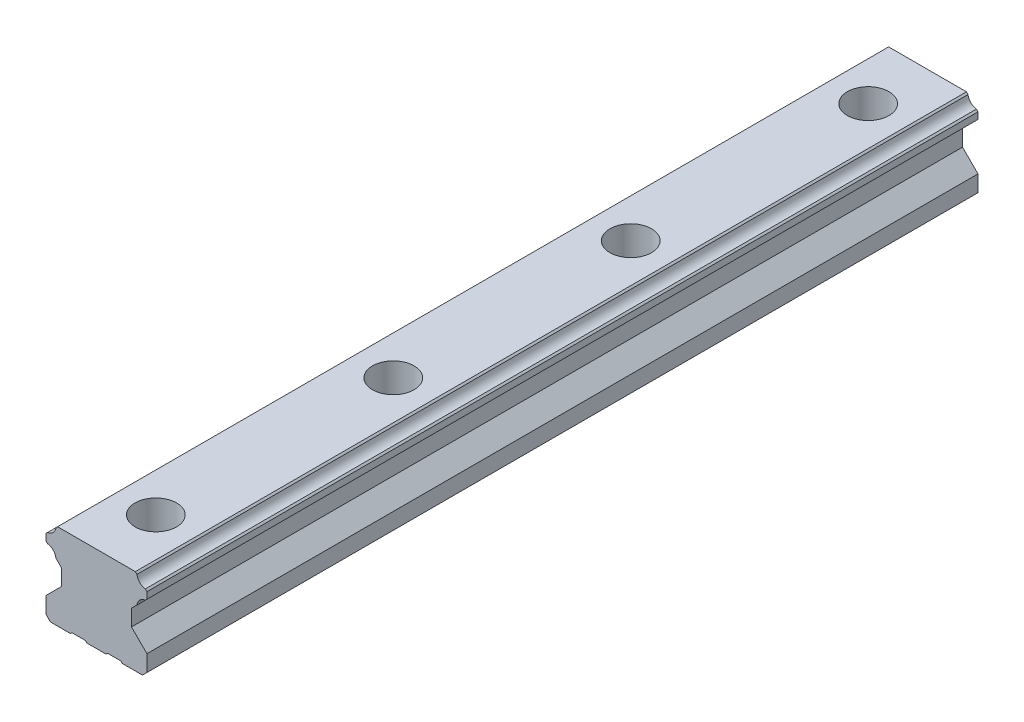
SolidWorks part; units mm, degrees
ref_plane "Front Plane" through (0, 0, 0) normal (0, 0, 1) x (1, 0, 0)
ref_plane "Top Plane" through (0, 0, 0) normal (0, 1, 0) x (1, 0, 0)
ref_plane "Right Plane" through (0, 0, 0) normal (1, 0, 0) x (0, 0, -1)
sketch "Sketch1" plane through (0, 0, 0) normal (0, 0, 1) x (1, 0, 0)
  line L0 (-13.6398, 28.4703) -> (-13.1102, 29)
  line L1 (-17, 25.1102) -> (-16.4686, 25.6415)
  line L2 (-17, 25.1102) -> (-17, 22.8793)
  line L3 (-16.4816, 22.3609) -> (-17, 22.8793)
  line L4 (-13.6381, 19.5174) -> (-11.8003, 17.6796)
  line L5 (-11.8003, 17.6796) -> (-11.8003, 12.1999)
  line L6 (-11.8003, 12.1999) -> (-17, 7.0002)
  line L7 (-17, 7.0002) -> (-17, 1.5)
  line L8 (-17, 1.5) -> (-15.5, 0)
  line L9 (-15.5, 0) -> (-8.745, 0)
  line L10 (-8.245, 0.5) -> (-8.745, 0)
  line L11 (-8.245, 0.5) -> (-3.75, 0.5)
  line L12 (-3.25, 0) -> (-3.75, 0.5)
  line L13 (-3.25, 0) -> (3.25, 0)
  line L14 (3.75, 0.5) -> (3.25, 0)
  line L15 (3.75, 0.5) -> (8.245, 0.5)
  line L16 (8.745, 0) -> (8.245, 0.5)
  line L17 (8.745, 0) -> (15.5, 0)
  line L18 (15.5, 0) -> (17, 1.5)
  line L19 (17, 1.5) -> (17, 7.0002)
  line L20 (17, 7.0002) -> (11.8003, 12.1999)
  line L21 (11.8003, 12.1999) -> (11.8003, 17.6796)
  line L22 (11.8003, 17.6796) -> (13.6381, 19.5174)
  line L23 (17, 22.8793) -> (16.4816, 22.3609)
  line L24 (17, 22.8793) -> (17, 25.1102)
  line L25 (16.4686, 25.6415) -> (17, 25.1102)
  line L26 (13.1102, 29) -> (13.6398, 28.4703)
  line L27 (-13.1102, 29) -> (13.1102, 29)
  arc A0 (-16.4686, 25.6415) -> (-13.6398, 28.4703) centre (-16.9102, 28.9119) ccw
  arc A1 (-13.6381, 19.5174) -> (-16.4816, 22.3609) centre (-16.9102, 19.0889) ccw
  arc A2 (16.4816, 22.3609) -> (13.6381, 19.5174) centre (16.9102, 19.0889) ccw
  arc A3 (13.6398, 28.4703) -> (16.4686, 25.6415) centre (16.9102, 28.9119) ccw
extrude "Boss-Extrude1" add sketch "Sketch1" along normal mid plane 280
hole_wizard "CBORE for M4 Hex Socket Head Cap Screw1" positions "Sketch2" profile "Sketch3" counterbore size "M4" standard "DIN"
sketch "Sketch2" plane through (0, 29, 0) normal (0, 1, 0) x (1, 0, 0)
  line L0 (13.1102, -140) -> (-13.1102, -140) construction
  point P0 (0, -120)
  dimension "D1" = 20
sketch "Sketch3" plane through (0, 29, 120) normal (1, 0, 0) x (0, 0, 1)
  line L0 (0, 0) -> (0, 29)
  line L1 (0, 29) -> (4.5, 29)
  line L3 (4.5, 29) -> (4.5, 12)
  line L4 (4.5, 12) -> (7, 12)
  line L5 (7, 12) -> (7, 0)
  line L7 (7, 0) -> (0, 0)
  line L11 (0, -6.35) -> (0, 107.95) construction
  dimension "Thru Hole Dia." = 9
  dimension "Thru Hole Depth" = 29
  dimension "C'Bore Dia." = 14
  dimension "C'Bore Depth" = 12
pattern_linear "LPattern1" count 4 spacing 80 along (0, 0, -1) of "CBORE for M4 Hex Socket Head Cap Screw1"
